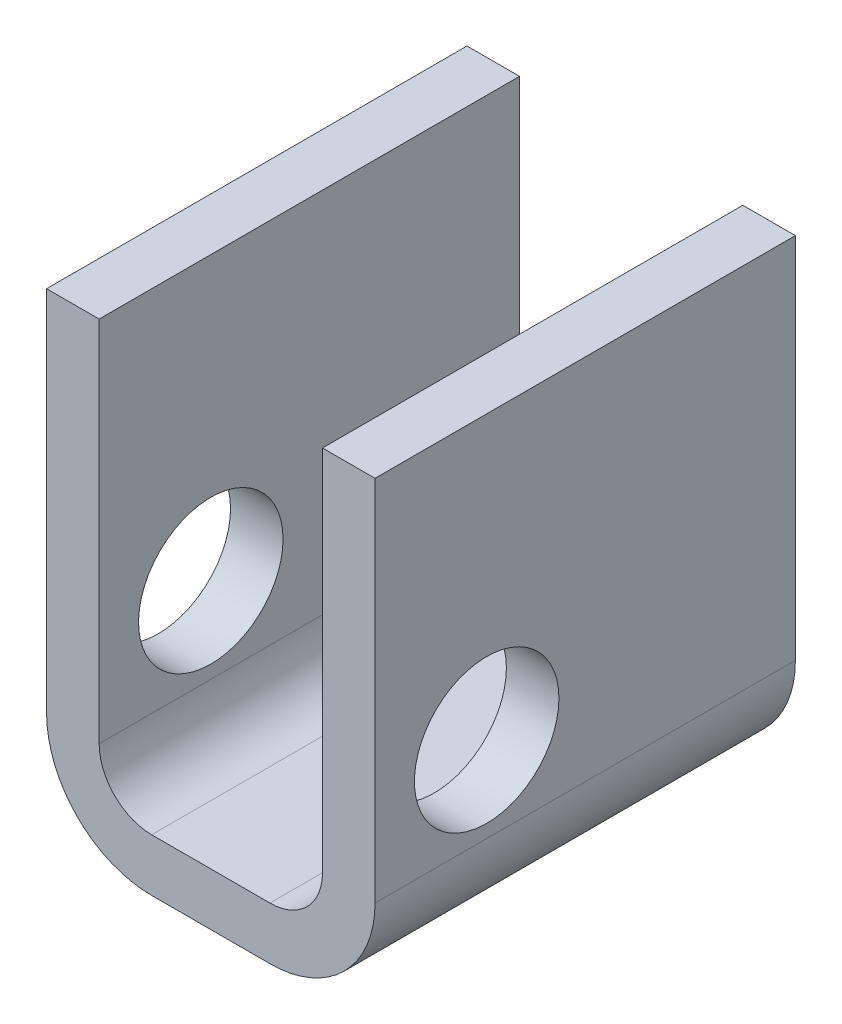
SolidWorks part; units mm, degrees
ref_plane "FRONT" through (0, 0, 0) normal (0, 0, 1) x (1, 0, 0)
ref_plane "TOP" through (0, 0, 0) normal (0, 1, 0) x (1, 0, 0)
ref_plane "RIGHT" through (0, 0, 0) normal (1, 0, 0) x (0, 0, -1)
sketch "Sketch1" plane through (0, 0, 0) normal (0, 0, 1) x (1, 0, 0)
  line L0 (13.4937, 6.35) -> (13.4938, 50.8)
  line L1 (19.8437, 6.35) -> (19.8437, 50.8)
  line L2 (-13.4937, 50.8) -> (-13.4937, 6.35)
  line L3 (-19.8437, 6.35) -> (-19.8437, 50.8)
  line L4 (-7.1437, 0) -> (7.1437, 0)
  line L5 (-7.1437, -6.35) -> (7.1437, -6.35)
  line L6 (13.4938, 50.8) -> (19.8437, 50.8)
  line L8 (-19.8437, 50.8) -> (-13.4937, 50.8)
  arc A0 (-7.1437, 0) -> (-13.4937, 6.35) centre (-7.1437, 6.35) cw
  arc A1 (7.1437, 0) -> (13.4937, 6.35) centre (7.1437, 6.35) ccw
  arc A2 (-7.1437, -6.35) -> (-19.8437, 6.35) centre (-7.1437, 6.35) cw
  arc A3 (7.1437, -6.35) -> (19.8437, 6.35) centre (7.1437, 6.35) ccw
  dimension "D1" = 6.35
  dimension "D3" = 6.35
  dimension "D4" = 57.15
  dimension "D5" = 39.6875
extrude "Extrude1" add sketch "Sketch1" along normal blind 50.8
sketch "Sketch2" plane through (19.8437, 0, 0) normal (1, 0, 0) x (0, 0, -1)
  line L1 (-50.8, 6.35) -> (-50.8, 50.8) construction
  line L2 (-50.8, 50.8) -> (0, 50.8) construction
  circle A0 centre (-37.3062, 16.6687) radius 8.7313
  dimension "D2" = 17.4625
  dimension "D3" = 34.1313
  dimension "D1" = 13.4937
extrude "Extrude2" cut sketch "Sketch2" against normal through all
